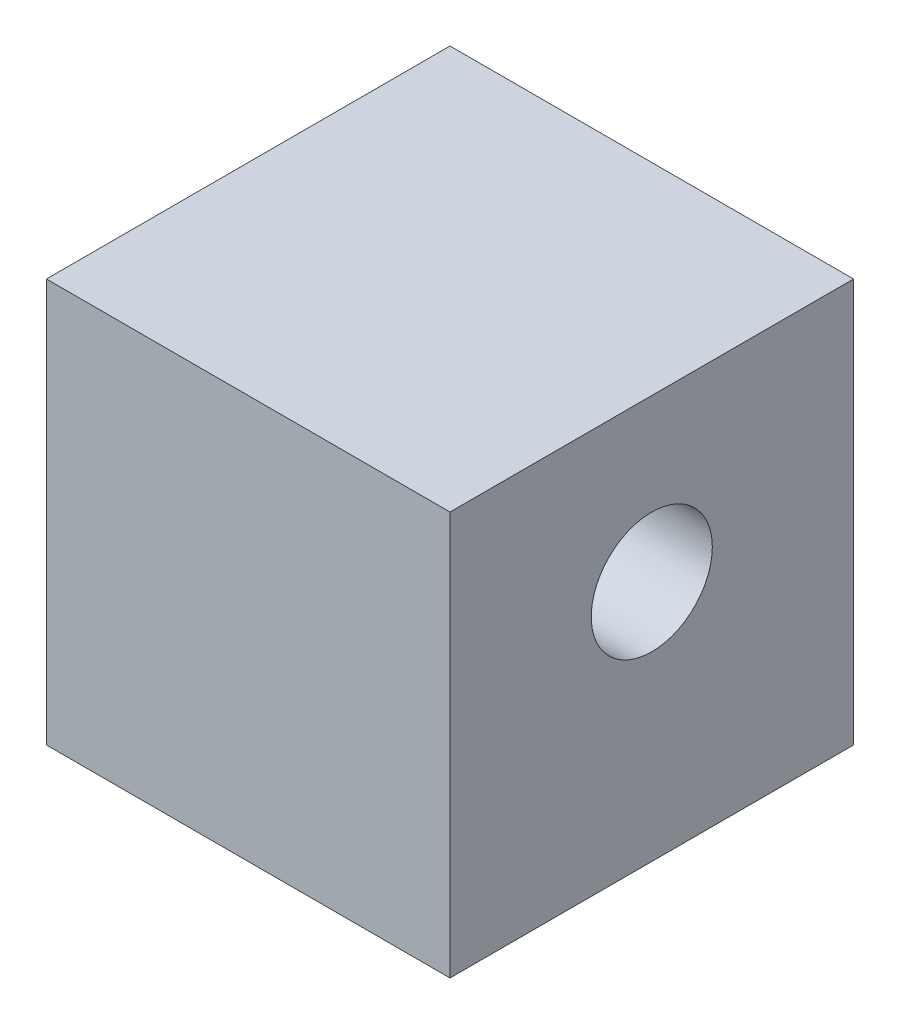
SolidWorks part; units mm, degrees
ref_plane "Front Plane" through (0, 0, 0) normal (0, 0, 1) x (1, 0, 0)
ref_plane "Top Plane" through (0, 0, 0) normal (0, 1, 0) x (1, 0, 0)
ref_plane "Right Plane" through (0, 0, 0) normal (1, 0, 0) x (0, 0, -1)
sketch "Sketch1" plane through (0, 0, 0) normal (0, 1, 0) x (1, 0, 0)
  line L1 (50, -50) -> (-50, -50)
  line L2 (50, -50) -> (50, 50)
  line L3 (50, 50) -> (-50, 50)
  line L4 (-50, -50) -> (-50, 50)
  line L5 (50, -50) -> (-50, 50) construction
  line L6 (50, 50) -> (-50, -50) construction
  point P0 (0, 0)
  dimension "D1" = 100
  dimension "D2" = 100
extrude "Boss-Extrude1" add sketch "Sketch1" along normal blind 100
sketch "Sketch2" plane through (50, 0, 0) normal (1, 0, 0) x (0, 0, -1)
  line L0 (-50, 100) -> (50, 100) construction
  circle A0 centre (0, 60) radius 15
  point P2 (0, 0)
  point P5 (0, 100)
  dimension "D1" = 30
  dimension "D2" = 40
extrude "Cut-Extrude1" cut sketch "Sketch2" against normal through all
